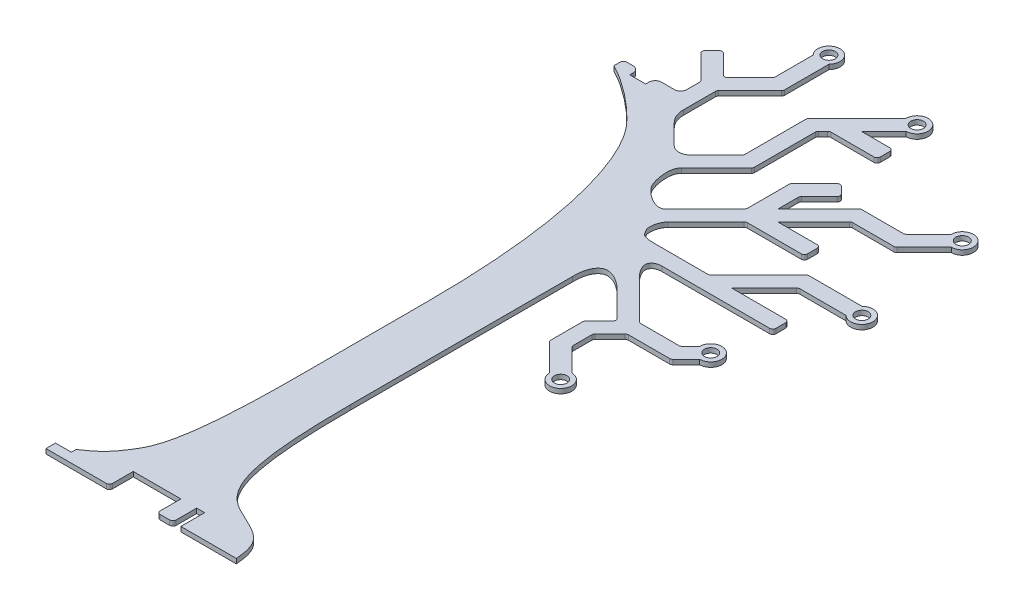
SolidWorks part; units mm, degrees
ref_plane "Front Plane" through (0, 0, 0) normal (0, 0, 1) x (1, 0, 0)
ref_plane "Top Plane" through (0, 0, 0) normal (0, 1, 0) x (1, 0, 0)
ref_plane "Right Plane" through (0, 0, 0) normal (1, 0, 0) x (0, 0, -1)
sketch "Sketch1" plane through (0, 0, 0) normal (0, 1, 0) x (1, 0, 0)
  line L0 (0, 30) -> (0, 45)
  line L1 (0, 45) -> (0, 30)
  line L2 (150, 10) -> (150, 75)
  line L3 (0, 0) -> (140, 0)
  line L4 (150, 75) -> (300, 75)
  line L5 (300, 75) -> (300, 10)
  line L6 (310, 0) -> (340, 0)
  line L7 (310, 600) -> (310, 1300)
  line L8 (-200, 1940) -> (-200, 1955)
  line L9 (-150, 1950) -> (-150, 1940)
  line L10 (163.6396, 1816.3604) -> (245.5635, 1898.2843)
  line L11 (-150, 1940) -> (-100, 1940)
  line L12 (-100, 1940) -> (-100, 1950)
  line L13 (150, 1000) -> (150, 600)
  line L14 (410, 1340) -> (494.8528, 1255.1472)
  line L15 (494.8528, 1241.0051) -> (452.4264, 1198.5786)
  line L16 (484.4975, 1771.7767) -> (608.6396, 1771.7767)
  line L17 (791.7767, 2011.4823) -> (827.132, 1976.127) construction
  line L18 (449.4975, 1191.5076) -> (449.4975, 1091.5076)
  line L19 (452.4264, 1084.4365) -> (537.2792, 999.5837)
  line L20 (772.0711, 1508.6396) -> (772.0711, 1478.6396)
  line L21 (572.6346, 1034.939) -> (502.4264, 1105.1472)
  line L22 (499.4975, 1112.2183) -> (499.4975, 1170.7969)
  line L23 (502.4264, 1177.868) -> (550.061, 1225.5025)
  line L24 (557.132, 1228.4315) -> (687.132, 1228.4315)
  line L25 (694.2031, 1231.3604) -> (736.6295, 1273.7868)
  line L26 (-170, 1970) -> (-190, 1970)
  line L27 (701.2742, 1309.1421) -> (673.4924, 1281.3604)
  line L28 (666.4214, 1278.4315) -> (546.4214, 1278.4315)
  line L29 (539.3503, 1281.3604) -> (412.0711, 1408.6396)
  line L30 (618.6396, 1761.7767) -> (618.6396, 1731.7767)
  line L31 (608.6396, 1721.7767) -> (438.6396, 1721.7767)
  line L32 (431.5685, 1718.8478) -> (311.3604, 1598.6396)
  line L33 (572.6346, 1034.939) -> (537.2792, 999.5837) construction
  line L34 (701.2742, 1309.1421) -> (736.6295, 1273.7868) construction
  line L35 (422.0711, 1468.6396) -> (762.0711, 1468.6396)
  line L36 (-200, 1960) -> (-200, 1955)
  line L37 (248.4924, 1905.3553) -> (248.4924, 2097.0711)
  line L38 (251.4214, 2104.1421) -> (404.0559, 2256.7767)
  line L39 (762.0711, 1518.6396) -> (592.0711, 1518.6396)
  line L40 (592.0711, 1518.6396) -> (694.7056, 1621.2742)
  line L41 (-20, 1990) -> (-20, 2030)
  line L42 (-22.9289, 2037.0711) -> (-97.1751, 2111.3173)
  line L43 (-97.1751, 2125.4594) -> (-75.9619, 2146.6726)
  line L44 (-61.8198, 2146.6726) -> (-2.0711, 2086.9239)
  line L45 (12.0711, 2086.9239) -> (81.9239, 2156.7767)
  line L46 (84.8528, 2163.8478) -> (84.8528, 2283.1371)
  line L47 (701.7767, 1624.2031) -> (847.6346, 1624.2031)
  line L48 (134.8528, 2283.1371) -> (134.8528, 2143.1371)
  line L49 (131.9239, 2136.066) -> (32.9289, 2037.0711)
  line L50 (30, 2030) -> (30, 1930)
  line L51 (269.4365, 1627.4264) -> (396.7157, 1754.7056)
  line L52 (399.6447, 1761.7767) -> (399.6447, 1891.7767)
  line L53 (402.5736, 1898.8478) -> (473.2843, 1969.5584)
  line L54 (487.4264, 1969.5584) -> (508.6396, 1948.3452)
  line L55 (508.6396, 1934.2031) -> (452.5736, 1878.1371)
  line L56 (449.6447, 1871.066) -> (449.6447, 1807.6346)
  line L57 (449.6447, 1807.6346) -> (576.9239, 1934.9138)
  line L58 (583.9949, 1937.8427) -> (713.9949, 1937.8427)
  line L59 (721.066, 1940.7716) -> (791.7767, 2011.4823)
  line L60 (113.6396, 1816.3604) -> (50, 1880)
  line L61 (827.132, 1976.127) -> (741.7767, 1890.7716)
  line L62 (734.7056, 1887.8427) -> (604.7056, 1887.8427)
  line L63 (597.6346, 1884.9138) -> (484.4975, 1771.7767)
  line L64 (847.6346, 1674.2031) -> (681.066, 1674.2031)
  line L65 (673.9949, 1671.2742) -> (524.2893, 1521.5685)
  line L66 (517.2183, 1518.6396) -> (351.3604, 1518.6396)
  line L67 (439.4113, 2221.4214) -> (368.7006, 2150.7107)
  line L68 (368.7006, 2150.7107) -> (458.7006, 2150.7107)
  line L69 (468.7006, 2140.7107) -> (468.7006, 2110.7107)
  line L70 (458.7006, 2100.7107) -> (322.8427, 2100.7107)
  line L71 (315.7716, 2097.7817) -> (301.4214, 2083.4315)
  line L72 (298.4924, 2076.3604) -> (298.4924, 1884.6447)
  line L73 (295.5635, 1877.5736) -> (185.3553, 1767.3654)
  line L74 (404.0559, 2256.7767) -> (439.4113, 2221.4214) construction
  line L75 (-80, 1970) -> (-40, 1970)
  line L76 (350, 10) -> (350, 75)
  line L77 (350, 75) -> (375, 75)
  line L78 (375, 75) -> (375, 0)
  line L79 (375, 0) -> (550, 0)
  line L80 (0, 30) -> (-50, 30)
  line L81 (-50, 30) -> (-50, 0)
  line L82 (-50, 0) -> (0, 0)
  arc A0 (736.6295, 1273.7868) -> (701.2742, 1309.1421) centre (736.2723, 1308.785) ccw
  circle A1 centre (736.2723, 1308.785) radius 20
  arc A2 (537.2792, 999.5837) -> (572.6346, 1034.939) centre (572.2774, 999.9409) ccw
  circle A3 centre (572.2774, 999.9409) radius 20
  arc A4 (827.132, 1976.127) -> (791.7767, 2011.4823) centre (826.7749, 2011.1252) ccw
  circle A5 centre (826.7749, 2011.1252) radius 20
  arc A6 (134.8528, 2283.1371) -> (84.8528, 2283.1371) centre (109.8528, 2307.632) ccw
  circle A7 centre (109.8528, 2307.632) radius 20
  arc A8 (131.9239, 2136.066) -> (134.8528, 2143.1371) centre (124.8528, 2143.1371) ccw
  arc A9 (81.9239, 2156.7767) -> (84.8528, 2163.8478) centre (74.8528, 2163.8478) ccw
  arc A10 (12.0711, 2086.9239) -> (-2.0711, 2086.9239) centre (5, 2093.9949) cw
  arc A11 (-61.8198, 2146.6726) -> (-75.9619, 2146.6726) centre (-68.8909, 2139.6016) ccw
  arc A12 (-97.1751, 2111.3173) -> (-97.1751, 2125.4594) centre (-90.1041, 2118.3883) cw
  arc A13 (30, 2030) -> (32.9289, 2037.0711) centre (40, 2030) cw
  arc A14 (-22.9289, 2037.0711) -> (-20, 2030) centre (-30, 2030) cw
  arc A15 (452.4264, 1084.4365) -> (449.4975, 1091.5076) centre (459.4975, 1091.5076) cw
  arc A16 (502.4264, 1105.1472) -> (499.4975, 1112.2183) centre (509.4975, 1112.2183) cw
  arc A17 (449.4975, 1191.5076) -> (452.4264, 1198.5786) centre (459.4975, 1191.5076) cw
  arc A18 (499.4975, 1170.7969) -> (502.4264, 1177.868) centre (509.4975, 1170.7969) cw
  arc A19 (550.061, 1225.5025) -> (557.132, 1228.4315) centre (557.132, 1218.4315) cw
  arc A20 (694.2031, 1231.3604) -> (687.132, 1228.4315) centre (687.132, 1238.4315) cw
  arc A21 (494.8528, 1241.0051) -> (494.8528, 1255.1472) centre (487.7817, 1248.0761) ccw
  arc A22 (539.3503, 1281.3604) -> (546.4214, 1278.4315) centre (546.4214, 1288.4315) ccw
  arc A23 (673.4924, 1281.3604) -> (666.4214, 1278.4315) centre (666.4214, 1288.4315) cw
  arc A24 (438.6396, 1721.7767) -> (431.5685, 1718.8478) centre (438.6396, 1711.7767) ccw
  arc A25 (399.6447, 1761.7767) -> (396.7157, 1754.7056) centre (389.6447, 1761.7767) cw
  arc A26 (399.6447, 1891.7767) -> (402.5736, 1898.8478) centre (409.6447, 1891.7767) cw
  arc A27 (473.2843, 1969.5584) -> (487.4264, 1969.5584) centre (480.3553, 1962.4874) cw
  arc A28 (508.6396, 1948.3452) -> (508.6396, 1934.2031) centre (501.5685, 1941.2742) cw
  arc A29 (452.5736, 1878.1371) -> (449.6447, 1871.066) centre (459.6447, 1871.066) ccw
  arc A30 (597.6346, 1884.9138) -> (604.7056, 1887.8427) centre (604.7056, 1877.8427) cw
  arc A31 (721.066, 1940.7716) -> (713.9949, 1937.8427) centre (713.9949, 1947.8427) cw
  arc A32 (576.9239, 1934.9138) -> (583.9949, 1937.8427) centre (583.9949, 1927.8427) cw
  arc A33 (741.7767, 1890.7716) -> (734.7056, 1887.8427) centre (734.7056, 1897.8427) cw
  arc A34 (618.6396, 1761.7767) -> (608.6396, 1771.7767) centre (608.6396, 1761.7767) ccw
  arc A35 (618.6396, 1731.7767) -> (608.6396, 1721.7767) centre (608.6396, 1731.7767) cw
  arc A36 (847.6346, 1624.2031) -> (847.6346, 1674.2031) centre (872.1295, 1649.2031) ccw
  circle A37 centre (872.1295, 1649.2031) radius 20
  arc A38 (762.0711, 1468.6396) -> (772.0711, 1478.6396) centre (762.0711, 1478.6396) ccw
  arc A39 (772.0711, 1508.6396) -> (762.0711, 1518.6396) centre (762.0711, 1508.6396) ccw
  arc A40 (694.7056, 1621.2742) -> (701.7767, 1624.2031) centre (701.7767, 1614.2031) cw
  arc A41 (681.066, 1674.2031) -> (673.9949, 1671.2742) centre (681.066, 1664.2031) ccw
  arc A42 (524.2893, 1521.5685) -> (517.2183, 1518.6396) centre (517.2183, 1528.6396) cw
  arc A43 (-150, 1950) -> (-170, 1970) centre (-170, 1950) ccw
  arc A44 (-190, 1970) -> (-200, 1960) centre (-190, 1960) ccw
  arc A45 (439.4113, 2221.4214) -> (404.0559, 2256.7767) centre (439.0541, 2256.4195) ccw
  circle A46 centre (439.0541, 2256.4195) radius 20
  arc A47 (50, 1880) -> (30, 1930) centre (98.3333, 1928.3333) cw
  arc A48 (113.6396, 1816.3604) -> (163.6396, 1816.3604) centre (138.6396, 1841.3604) ccw
  arc A49 (248.4924, 2097.0711) -> (251.4214, 2104.1421) centre (258.4924, 2097.0711) cw
  arc A50 (245.5635, 1898.2843) -> (248.4924, 1905.3553) centre (238.4924, 1905.3553) ccw
  arc A51 (298.4924, 1884.6447) -> (295.5635, 1877.5736) centre (288.4924, 1884.6447) cw
  arc A52 (301.4214, 2083.4315) -> (298.4924, 2076.3604) centre (308.4924, 2076.3604) ccw
  arc A53 (322.8427, 2100.7107) -> (315.7716, 2097.7817) centre (322.8427, 2090.7107) ccw
  arc A54 (468.7006, 2110.7107) -> (458.7006, 2100.7107) centre (458.7006, 2110.7107) cw
  arc A55 (458.7006, 2150.7107) -> (468.7006, 2140.7107) centre (458.7006, 2140.7107) cw
  arc A56 (300, 10) -> (310, 0) centre (310, 10) ccw
  arc A57 (150, 10) -> (140, 0) centre (140, 10) cw
  arc A58 (-100, 1950) -> (-80, 1970) centre (-80, 1950) cw
  arc A59 (-40, 1970) -> (-20, 1990) centre (-40, 1990) ccw
  arc A60 (350, 10) -> (340, 0) centre (340, 10) cw
  spline S0 degree 3 poles (550, 0) (544.0745, 70.0362) (523.1285, 94.0473) (360.3993, 163.9018) (310, 258.3544) (310, 600) knots 0 0 0 0 0.457682 0.557682 1 1 1 1
  spline S1 degree 3 poles (0, 45) (42.1901, 73.1594) (64.8662, 93.7087) (131.0965, 207.9702) (150, 358.4686) (150, 600) knots 0 0 0 0 0.473246 0.573246 1 1 1 1
  spline S2 degree 3 poles (150, 1000) (150, 1445.6023) (51.0066, 1725.0167) (-78.9768, 1863.4737) (-152.2875, 1915.5792) (-200, 1940) knots 0 0 0 0 0.48487 0.58487 1 1 1 1
  spline S3 degree 3 poles (310, 1300) (308.9247, 1340.2762) (324.1056, 1364.6524) (352.7445, 1374.583) (380.182, 1365.9814) (410, 1340) knots 0 0 0 0 0.489063 0.589063 1 1 1 1
  spline S4 degree 3 poles (185.3553, 1767.3654) (165.8832, 1747.8933) (178.1537, 1680.7264) (216.0294, 1636.5724) (253.8231, 1617.4314) (269.4365, 1627.4264) knots 0 0 0 0 0.315307 0.415307 1 1 1 1
  spline S5 degree 3 poles (412.0711, 1408.6396) (401.49, 1419.3298) (390.3738, 1439.6713) (394.1218, 1461.2397) (408.0263, 1468.4613) (422.0711, 1468.6396) knots 0 0 0 0 0.389885 0.489885 1 1 1 1
  spline S6 degree 3 poles (351.3604, 1518.6396) (307.601, 1518.4773) (309.6344, 1527.5424) (291.4505, 1551.931) (296.4535, 1582.0671) (311.3604, 1598.6396) knots 0 0 0 0 0.455017 0.455017 1 1 1 1
  point P49 (537.5305, 1070.0431)
  point P79 (480.6066, 1906.1701)
  point P148 (772.0711, 1468.6396)
  point P152 (772.0711, 1518.6396)
  point P155 (697.6346, 1624.2031)
  point P158 (676.9239, 1674.2031)
  point P161 (521.3604, 1518.6396)
  point P162 (-150, 1970)
  point P165 (-200, 1970)
  point P170 (298.4924, 1980.5025)
  point P189 (248.4924, 2101.2132)
  point P192 (248.4924, 1901.2132)
  point P195 (298.4924, 1880.5025)
  point P204 (468.7006, 2150.7107)
  point P209 (300, 0)
  point P212 (150, 0)
  point P214 (-100, 1970)
  point P218 (-20, 1970)
  point P227 (0, 0)
  point P228 (0, 0)
extrude "Boss-Extrude1" add sketch "Sketch1" along normal blind 15
equation "\"BranchWidth\"= 50mm"
equation "\"StockThickness\"= 15mm"
equation "\"D16@Sketch1\"= \"BranchWidth\""
equation "\"D1@Sketch1\"= \"StockThickness\" * 5"
equation "\"D17@Sketch1\"= \"BranchWidth\""
equation "\"D18@Sketch1\"= \"BranchWidth\""
equation "\"D19@Sketch1\"= \"BranchWidth\""
equation "\"D20@Sketch1\"= \"BranchWidth\""
equation "\"D21@Sketch1\"= \"BranchWidth\""
equation "\"D22@Sketch1\"= \"BranchWidth\""
equation "\"D23@Sketch1\"= \"BranchWidth\""
equation "\"D24@Sketch1\"= \"BranchWidth\""
equation "\"D25@Sketch1\"= \"BranchWidth\""
equation "\"D26@Sketch1\"= \"BranchWidth\""
equation "\"D27@Sketch1\"= \"BranchWidth\""
equation "\"D28@Sketch1\"= \"BranchWidth\""
equation "\"D29@Sketch1\"= \"BranchWidth\""
equation "\"D15@Sketch1\"= \"BranchWidth\""
equation "\"LeafHoleDiameter\"= 40mm"
equation "\"D30@Sketch1\"= \"LeafHoleDiameter\""
equation "\"D34@Sketch1\"= \"LeafHoleDiameter\""
equation "\"D35@Sketch1\"= \"LeafHoleDiameter\""
equation "\"D36@Sketch1\"= \"LeafHoleDiameter\""
equation "\"D33@Sketch1\"=\"BranchWidth\""
equation "\"LeafRadius\"= 35mm"
equation "\"D38@Sketch1\"= \"LeafRadius\""
equation "\"D39@Sketch1\"= \"LeafRadius\""
equation "\"D40@Sketch1\"= \"LeafRadius\""
equation "\"D41@Sketch1\"= \"LeafRadius\""
equation "\"D1@Boss-Extrude1\"=\"StockThickness\""
equation "\"D69@Sketch1\"=\"BranchWidth\""
equation "\"D71@Sketch1\"=\"BranchWidth\""
equation "\"D72@Sketch1\"=\"BranchWidth\""
equation "\"D9@Sketch1\"=\"StockThickness\""
equation "\"D80@Sketch1\"=\"LeafRadius\""
equation "\"D79@Sketch1\"=\"LeafHoleDiameter\""
equation "\"D106@Sketch1\"=\"BranchWidth\""
equation "\"D105@Sketch1\"=\"LeafRadius\""
equation "\"D104@Sketch1\"=\"LeafHoleDiameter\""
equation "\"D107@Sketch1\"=\"BranchWidth\""
equation "\"D108@Sketch1\"=\"BranchWidth\""
equation "\"D110@Sketch1\"=\"BranchWidth\""
equation "\"D122@Sketch1\"=10.00mm"
equation "\"D128@Sketch1\"=\"StockThickness\"*2"
equation "\"D42@Sketch1\"=\"StockThickness\""
